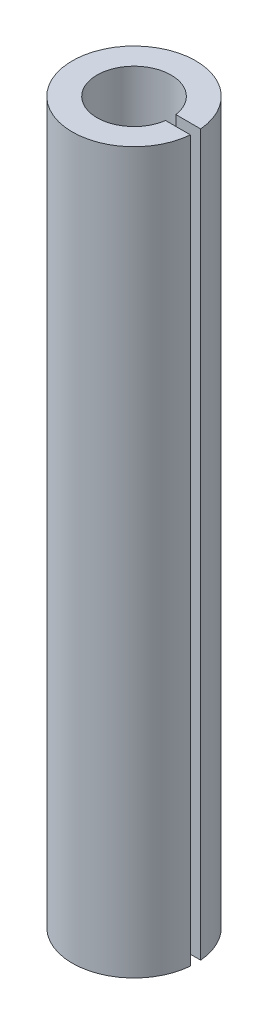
SolidWorks part; units mm, degrees
ref_plane "Face" through (0, 0, 0) normal (0, 0, 1) x (1, 0, 0)
ref_plane "Dessus" through (0, 0, 0) normal (0, 1, 0) x (1, 0, 0)
ref_plane "Droite" through (0, 0, 0) normal (1, 0, 0) x (0, 0, -1)
sketch "Esquisse1" plane through (0, 0, 0) normal (0, 1, 0) x (1, 0, 0)
  line L0 (1.7826, 0.25) -> (2.9896, 0.25)
  line L1 (1.7826, -0.25) -> (2.9896, -0.25)
  arc A0 (2.9896, 0.25) -> (2.9896, -0.25) centre (0, 0) ccw
  arc A1 (1.7826, 0.25) -> (1.7826, -0.25) centre (0, 0) ccw
  dimension "D1" = 6
  dimension "D2" = 3.6
  dimension "D3" = 0.5
  dimension "D4" = 0.25
extrude "Base-Extrusion" add sketch "Esquisse1" along normal mid plane 35
